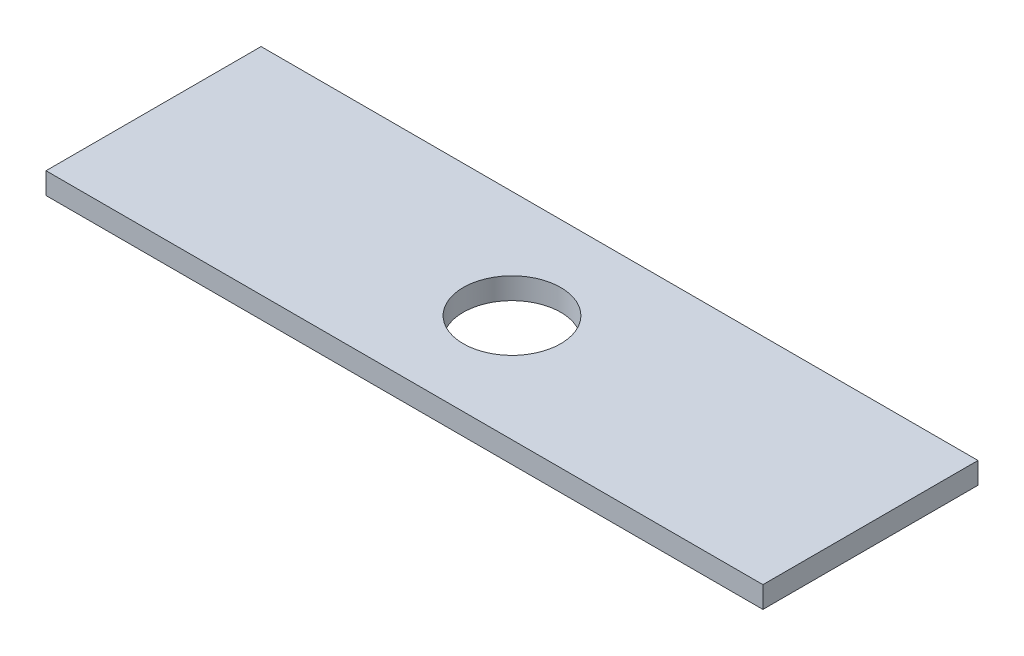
SolidWorks part; units mm, degrees
ref_plane "Plan de face" through (0, 0, 0) normal (0, 0, 1) x (1, 0, 0)
ref_plane "Plan de dessus" through (0, 0, 0) normal (0, 1, 0) x (1, 0, 0)
ref_plane "Plan de droite" through (0, 0, 0) normal (1, 0, 0) x (0, 0, -1)
sketch "Esquisse1" plane through (0, 0, 0) normal (0, 1, 0) x (1, 0, 0)
  line L1 (-25, -7.5) -> (25, -7.5)
  line L2 (-25, -7.5) -> (-25, 7.5)
  line L3 (-25, 7.5) -> (25, 7.5)
  line L4 (25, -7.5) -> (25, 7.5)
  circle A0 centre (0, 0) radius 3.4
  dimension "D1" = 6.8
  dimension "D2" = 50
  dimension "D3" = 15
  dimension "D4" = 25
  dimension "D5" = 7.5
extrude "Extrusion1" add sketch "Esquisse1" along normal blind 1.5
